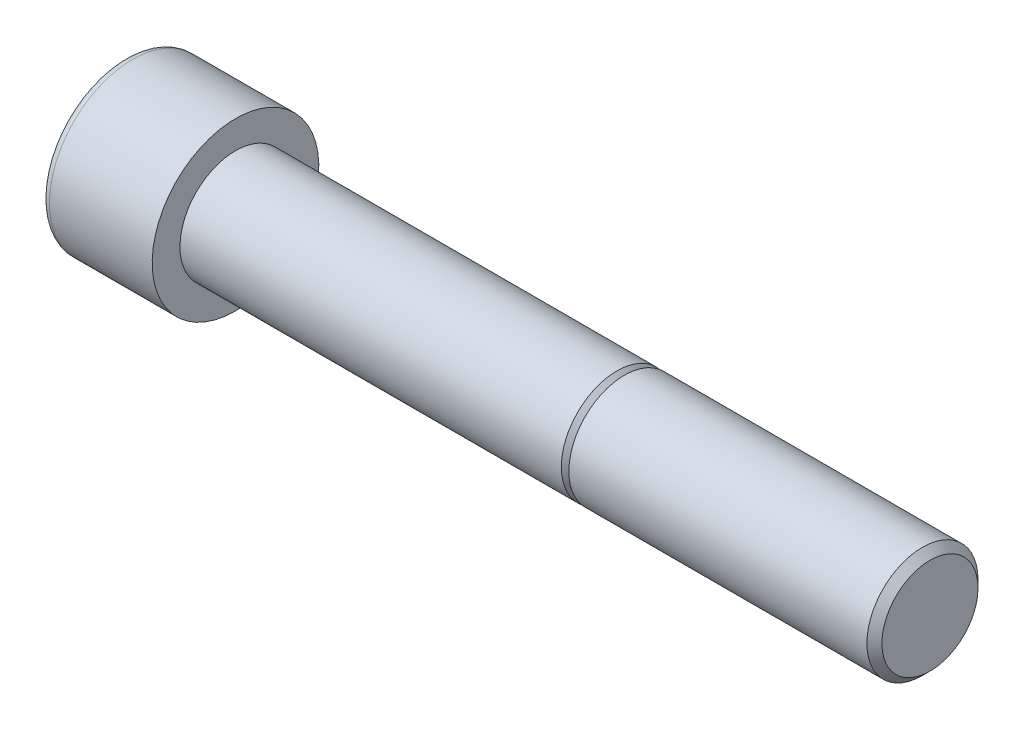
SolidWorks part; units mm, degrees
ref_plane "Plan de face" through (0, 0, 0) normal (0, 0, 1) x (1, 0, 0)
ref_plane "Plan de dessus" through (0, 0, 0) normal (0, 1, 0) x (1, 0, 0)
ref_plane "Plan de droite" through (0, 0, 0) normal (1, 0, 0) x (0, 0, -1)
ref_plane "Plan1" through (0, 0, 0) normal (0, 0, -1) x (-1, 0, 0)
sketch "Esquisse1" plane through (0, 0, 0) normal (0, 0, -1) x (-1, 0, 0)
  line L0 (-80, 8) -> (-80, 0)
  line L1 (-80, 0) -> (36, 0)
  line L2 (36, 0) -> (36, 12)
  line L3 (36, 12) -> (20, 12)
  line L4 (20, 12) -> (20, 8)
  line L5 (20, 8) -> (-34.9175, 8)
  line L6 (-34.9175, 8) -> (-36, 6.9175)
  line L7 (-36, 6.9175) -> (-36, 8)
  line L8 (-36, 8) -> (-80, 8)
  line L9 (-80, 0) -> (36, 0) construction
  dimension "D1" = 16
  dimension "D2" = 44
  dimension "D3" = 135
  dimension "D4" = 100
revolve "Révolution1" add sketch "Esquisse1" angle 360 about L9
sketch "Esquisse2" plane through (-36, 0, 0) normal (-1, 0, 0) x (0, 0, 1)
  line L0 (-7, -4.0415) -> (0, -8.0829)
  line L1 (0, -8.0829) -> (7, -4.0415)
  line L2 (7, -4.0415) -> (7, 4.0415)
  line L3 (7, 4.0415) -> (0, 8.0829)
  line L4 (0, 8.0829) -> (-7, 4.0415)
  line L5 (-7, 4.0415) -> (-7, -4.0415)
extrude "Enlèv. mat.-Extru.1" cut sketch "Esquisse2" against normal blind 8
chamfer "Chanfrein1" distance 1.0825 angle 45 1 edges at (80, -8, 0)
fillet "Congé1" radius 1.2 1 edges at (-36, -12, 0)
